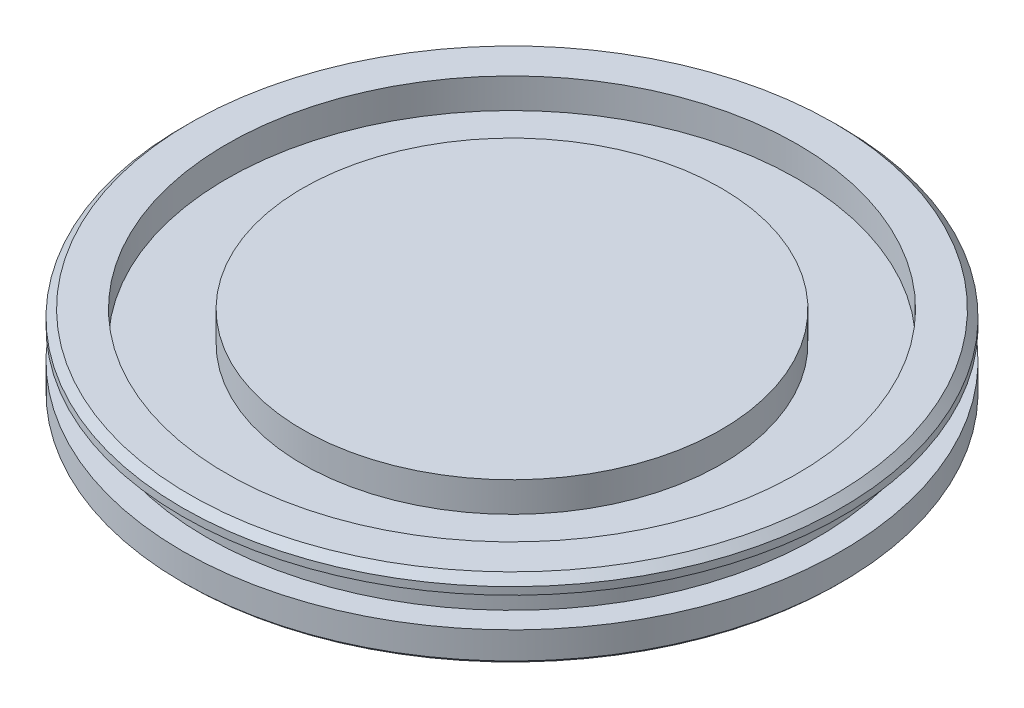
SolidWorks part; units mm, degrees
ref_plane "Front Plane" through (0, 0, 0) normal (0, 0, 1) x (1, 0, 0)
ref_plane "Top Plane" through (0, 0, 0) normal (0, 1, 0) x (1, 0, 0)
ref_plane "Right Plane" through (0, 0, 0) normal (1, 0, 0) x (0, 0, -1)
sketch "Sketch1" plane through (0, 0, 0) normal (0, 0, 1) x (1, 0, 0)
  line L0 (0, 0) -> (0, 44.6601) construction
  line L1 (0, -2.5) -> (0, -5) construction
  line L2 (0, -5) -> (-12.9366, -5) construction
  line L3 (0, 0) -> (-6.985, 0)
  line L4 (-11, 0) -> (-11, -0.5)
  line L5 (-11, -0.5) -> (-10.2, -0.5)
  line L6 (-10.2, -0.5) -> (-10.2, -1.5)
  line L7 (-10.2, -1.5) -> (-11, -1.5)
  line L8 (-11, -1.5) -> (-11, -2.5)
  line L9 (-11, -2.5) -> (0, -2.5)
  line L10 (-11, -2.5) -> (-11, -3.5) construction
  line L11 (-11, -3.5) -> (-11.7367, -3.5) construction
  line L12 (0, -2.5) -> (0, 0)
  line L13 (0, 0) -> (-68.5328, 0) construction
  line L14 (-9.525, 0) -> (-9.525, -1)
  line L15 (-9.525, -1) -> (-6.985, -1)
  line L16 (-6.985, -1) -> (-6.985, 0)
  line L17 (-9.525, 0) -> (-11, 0)
  circle A0 centre (0, -1) radius 12 construction
  dimension "D5" = 1
  dimension "D6" = 24
  dimension "D1" = 1
  dimension "D2" = 0.8
  dimension "D3" = 22
  dimension "D4" = 1
  dimension "D7" = 2.5
  dimension "D8" = 1
  dimension "D9" = 2.5
  dimension "D10" = 0.7367
  dimension "D11" = 19.05
  dimension "D12" = 13.97
  dimension "D13" = 1
revolve "Revolve1" add sketch "Sketch1" angle 360 about L0
chamfer "Chamfer1" distance 0.25 angle 45 1 edges at (0, 0, -11)
chamfer "Chamfer2" distance 0.1 angle 45 1 edges at (0, -2.5, -11)
